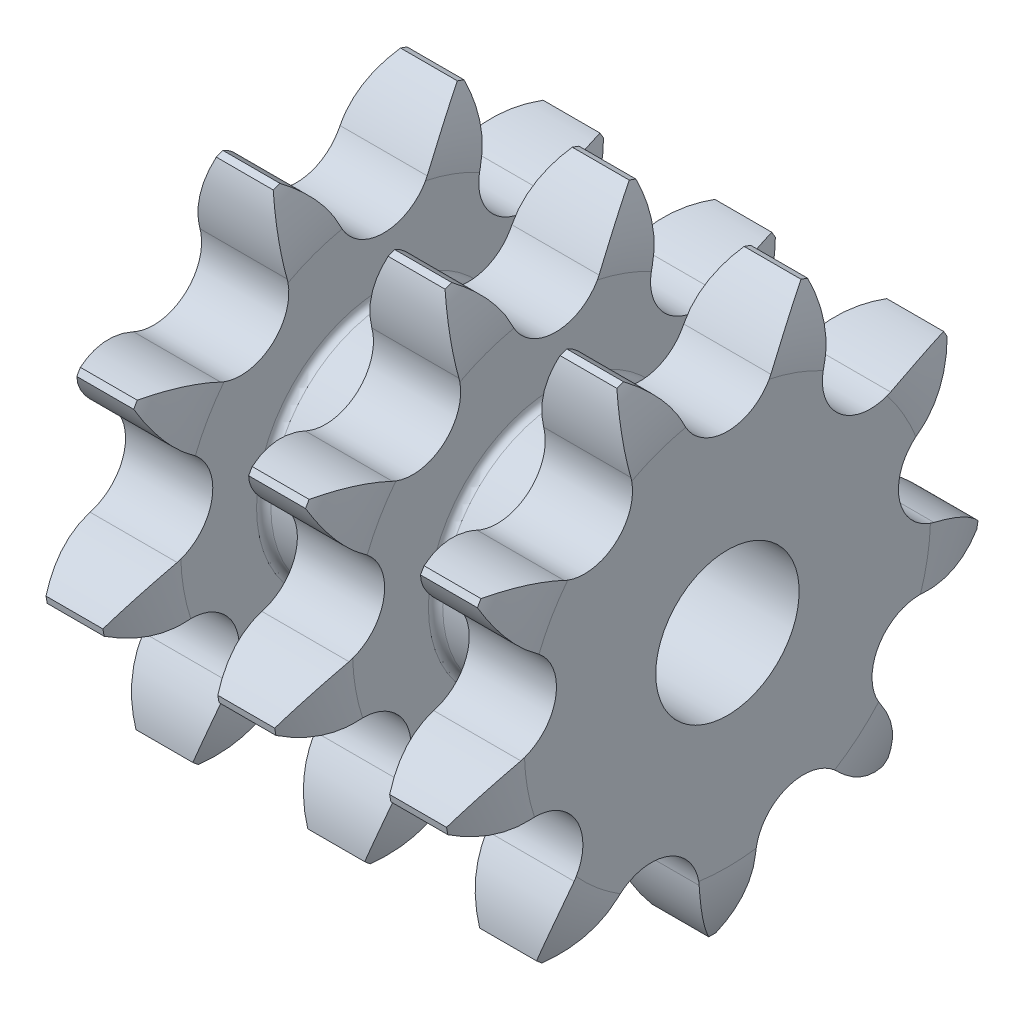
SolidWorks part; units mm, degrees
ref_plane "Plane1" through (0, 0, 0) normal (0, 0, 1) x (1, 0, 0)
ref_plane "Plane2" through (0, 0, 0) normal (0, 1, 0) x (1, 0, 0)
ref_plane "Plane3" through (0, 0, 0) normal (1, 0, 0) x (0, 0, -1)
sketch "Clipboard" plane through (0, 0, 0) normal (0, 1, 0) x (1, 0, 0)
  line L0 (0, 0) -> (12.5436, -1.9867)
  line L1 (-15, 0) -> (100, 0) construction
  line L2 (0, 0) -> (-0.8416, 0.9512)
  line L3 (0, 0) -> (-11.863, 4.5341)
  line L4 (0, 0) -> (3.0618, 0.4849)
  line L5 (0, 0) -> (-2.8109, -1.0484)
  line L6 (0, 0) -> (-29.8924, -20.1685)
  line L7 (-0.8416, 0.9512) -> (36.5829, 8.906)
  line L8 (-76.2, 38.1) -> (-75.2, 38.1)
  line L9 (-73.4321, 41.7084) -> (-72.837, 41.7846)
  line L10 (-73.4741, 12.9512) -> (-59.0941, 12.9512)
  circle A0 centre (0, 0) radius 3.975
  circle A1 centre (0, 0) radius 10.0465
  circle A2 centre (0, 0) radius 25
sketch "BasProSke" plane through (0, 0, 0) normal (0, 1, 0) x (1, 0, 0)
  line L0 (-10, 0) -> (60, 0) construction
  line L1 (0, 0) -> (0, 16.9929)
  line L2 (0, 0) -> (36.06, 0)
  line L3 (36.06, 0) -> (36.06, 16.9929)
  line L4 (34.79, 22.5287) -> (1.27, 22.5287)
  arc A0 (0, 16.9929) -> (1.27, 22.5287) centre (12.7, 16.9929) cw
  arc A1 (36.06, 16.9929) -> (34.79, 22.5287) centre (23.36, 16.9929) ccw
revolve "Base-Revolve" add sketch "BasProSke" angle 360 about L0
sketch "GrvSke" plane through (0, 0, 0) normal (0, 1, 0) x (1, 0, 0)
  line L0 (7.3, 16.9929) -> (7.3, 10.6465)
  line L1 (7.9, 10.0465) -> (13.78, 10.0465)
  line L2 (14.38, 10.6465) -> (14.38, 16.9929)
  line L3 (6.03, 22.5287) -> (15.65, 22.5287)
  line L4 (10.84, 0) -> (10.84, 52.07) construction
  line L5 (-10, 0) -> (60, 0) construction
  line L6 (0, 0) -> (35.56, 0) construction
  arc A0 (14.38, 16.9929) -> (15.65, 22.5287) centre (27.08, 16.9929) cw
  arc A1 (7.3, 16.9929) -> (6.03, 22.5287) centre (-5.4, 16.9929) ccw
  arc A2 (7.3, 10.6465) -> (7.9, 10.0465) centre (7.9, 10.6465) ccw
  arc A3 (13.78, 10.0465) -> (14.38, 10.6465) centre (13.78, 10.6465) ccw
revolve "Groove" cut sketch "GrvSke" angle 360 about L6
pattern_linear "Grooves" count 2 spacing 14.38 along (1, 0, 0) of "Groove"
sketch "TooCutSke" plane through (0, 0, 0) normal (1, 0, 0) x (0, 0, -1)
  line L0 (0, 18.6059) -> (3.6386, 16.9092) construction
  line L1 (0, 0) -> (0, 107) construction
  line L2 (0, 18.6059) -> (-10, 18.6059) construction
  line L3 (0, 18.6059) -> (-3.6386, 16.9092) construction
  arc A0 (3.6386, 16.9092) -> (7.9748, 21.6037) centre (13.1494, 12.4742) cw
  arc A1 (3.6386, 16.9092) -> (-3.6386, 16.9092) centre (0, 18.6059) cw
  arc A2 (-3.6386, 16.9092) -> (-7.9748, 21.6037) centre (-13.1494, 12.4742) ccw
  arc A3 (7.9748, 21.6037) -> (-7.9748, 21.6037) centre (0, 0) ccw
extrude "ToothCut" cut sketch "TooCutSke" along normal through all
pattern_circular "TeethCuts" count 9 every 40 about axis through (-10, 0, 0) along (1, 0, 0) of "ToothCut"
sketch "HubNeaOneSke" plane through (0, 0, 0) normal (-1, 0, 0) x (0, 0, 1)
  circle A0 centre (0, 0) radius 10.0465
extrude "HubNearOne" [suppressed] add sketch "HubNeaOneSke" along normal blind 2.2005
fillet "HubNearOneFillet" [suppressed] radius 0.6
sketch "HubNeaBotSke" plane through (0, 0, 0) normal (-1, 0, 0) x (0, 0, 1)
  circle A0 centre (0, 0) radius 10.0465
extrude "HubNearBoth" [suppressed] add sketch "HubNeaBotSke" along normal blind 1.1003
fillet "HubNearBothFillet" [suppressed] radius 0.6
ref_plane "FarPln" through (36.06, 0, 0) normal (1, 0, 0) x (0, 0, -1)
sketch "HubFarSke" plane through (36.06, 0, 0) normal (1, 0, 0) x (0, 0, -1)
  circle A0 centre (0, 0) radius 10.0465
extrude "HubFar" [suppressed] add sketch "HubFarSke" along normal blind 1.1003
fillet "HubFarFillet" [suppressed] radius 0.6
sketch "BorSke" plane through (0, 0, 0) normal (1, 0, 0) x (0, 0, -1)
  circle A0 centre (0, 0) radius 6
extrude "Bore" cut sketch "BorSke" along normal mid plane 76.521
sketch "KeySke" plane through (0, 0, 0) normal (1, 0, 0) x (0, 0, -1)
  line L0 (-1, 0) -> (-1, 7)
  line L1 (-1, 7) -> (1, 7)
  line L2 (1, 7) -> (1, 0)
  line L3 (0, 0) -> (0, 34) construction
  line L4 (-1, 0) -> (1, 0)
extrude "Keyway" [suppressed] cut sketch "KeySke" along normal mid plane 76.521
pattern_circular "Keyway2" [suppressed] count 2 every 90 about axis through (-10, 0, 0) along (1, 0, 0)
equation "\"Num_teethClipboard_v1\" =  int( \"Num_teeth@Clipboard\" )"
equation "\"Num_teethClipboard_v2\" =  ((sgn( \"Num_teethClipboard_v1\" - 5.0)+1)*( \"Num_teethClipboard_v1\" - 5.0))/2 +5.0"
equation "\"Num_teeth@Clipboard\" =  ((sgn( \"Num_teethClipboard_v2\" - 200.0)-1)*( \"Num_teethClipboard_v2\" - 200.0))/-2 +200.0"
equation "\"MHDClipboard_v1\" =  \"Pitch@Clipboard\" * (1.0 / tan(3.14159265 / \"Num_teeth@Clipboard\" )) - 1.05 * \"Plate_wid@Clipboard\" - 2.0 * \"Fillet_rad@Clipboard\" - 1.0"
equation "\"Thickness@Clipboard\" =  \"Face_width@Clipboard\" + (\"Num_strands@Clipboard\" - 1) * \"Transv_pitch@Clipboard\""
equation "\"OALClipboard_v1\" =  \"Thickness@Clipboard\" + 2 * \"Fillet_rad@Clipboard\" + 1"
equation "\"MHD@Clipboard\" =  ((sgn( \"MHDClipboard_v1\" - \"Hub_dia@Clipboard\" )-1)*( \"MHDClipboard_v1\" - \"Hub_dia@Clipboard\" ))/-2+ \"Hub_dia@Clipboard\""
equation "\"OAL@Clipboard\" =  ((sgn( \"OALClipboard_v1\" - \"Overall_len@Clipboard\" )+1)*( \"OALClipboard_v1\" - \"Overall_len@Clipboard\" ))/2 + \"Overall_len@Clipboard\" + 0.0005"
equation "\"Num_teethTeethCuts_v1\" =  int( \"Show_teeth@Clipboard\" ) + 1"
equation "\"Num_teethTeethCuts_v2\" =  ((sgn( \"Num_teethTeethCuts_v1\" - \"Num_teeth@Clipboard\" )-1)*( \"Num_teethTeethCuts_v1\" - \"Num_teeth@Clipboard\" ))/-2+ \"Num_teeth@Clipboard\""
equation "\"Num_teeth@TeethCuts\" =  ((sgn( \"Num_teethTeethCuts_v2\" - 2.0)+1)*( \"Num_teethTeethCuts_v2\" - 2.0))/2 +2.0"
equation "\"Angle@TeethCuts\" =  360.0 / \"Num_teeth@Clipboard\""
equation "\"Seat_radius@TooCutSke\" =  ( \"Pitch@Clipboard\" / 2.0) / sin(3.14159265 / \"Num_teeth@Clipboard\" ) - \"Dr@Clipboard\" / 2.0 + \"Dr@Clipboard\" * 0.505"
equation "\"R1@TooCutSke\" =  \"Dr@Clipboard\" * 0.505"
equation "\"X@TooCutSke\" =  140.0 - (90.0 / \"Num_teeth@Clipboard\")"
equation "\"R2@TooCutSke\" =  0.12 * \"Dr@Clipboard\" * ( \"Num_teeth@Clipboard\" + 2.0)"
equation "\"Overcut@TooCutSke\" =  0.5 + 0.625 * \"Pitch@Clipboard\" - 0.5 * \"Dr@Clipboard\"  +  \"Pitch@Clipboard\" / 2.0 / sin(3.14159265 / \"Num_teeth@Clipboard\" )"
equation "\"Diameter@BasProSke\" =  2.0 * ( 0.625 * \"Pitch@Clipboard\" - 0.5 * \"Dr@Clipboard\"  +  \"Pitch@Clipboard\" / 2.0 / sin(3.14159265 / \"Num_teeth@Clipboard\" ))"
equation "\"Thickness@BasProSke\" =  \"Thickness@Clipboard\""
equation "\"G1@BasProSke\" =  \"Side_relief@Clipboard\""
equation "\"G2@BasProSke\" =  \"Side_relief@Clipboard\""
equation "\"D1@BasProSke\" =  \"Side_radius@Clipboard\""
equation "\"Diameter@GrvSke\" =  \"Diameter@BasProSke\""
equation "\"G1@GrvSke\" =  \"Side_relief@Clipboard\""
equation "\"D1@GrvSke\" =  \"Side_radius@Clipboard\""
equation "\"Grv_diam@GrvSke\" =  \"Pitch@Clipboard\" * (1.0 / tan(3.14159265 / \"Num_teeth@Clipboard\" ))- 1.05 * \"Plate_wid@Clipboard\" - 2.0 * \"Fillet_rad@Clipboard\" - 1.0"
equation "\"Grv_width@GrvSke\" =  \"Transv_pitch@Clipboard\" - \"Face_width@Clipboard\""
equation "\"Offset@GrvSke\" =  \"Grv_width@GrvSke\" / 2.0 + \"Face_width@Clipboard\""
equation "\"Fillet_rad@GrvSke\" =  \"Fillet_rad@Clipboard\""
equation "\"Offset@Grooves\" =  \"Transv_pitch@Clipboard\""
equation "\"Num_grvsGrooves_v1\" =  \"Num_strands@Clipboard\""
equation "\"Num_grvs@Grooves\" =  \"Num_grvsGrooves_v1\" - 1 * sgn( \"Num_grvsGrooves_v1\" -1)"
equation "\"Diameter@HubNeaOneSke\" =  \"MHD@Clipboard\""
equation "\"Length@HubNearOne\" =  \"OAL@Clipboard\" - \"Thickness@BasProSke\""
equation "\"Diameter@HubNeaBotSke\" =  \"MHD@Clipboard\""
equation "\"Length@HubNearBoth\" =  ( \"OAL@Clipboard\" - \"Thickness@BasProSke\" ) / 2.0"
equation "\"D1@HubNearOneFillet\" =  \"Fillet_rad@Clipboard\""
equation "\"D1@HubNearBothFillet\" =  \"Fillet_rad@Clipboard\""
equation "\"Thickness@FarPln\" =  \"Thickness@BasProSke\""
equation "\"Diameter@HubFarSke\" =  \"MHD@Clipboard\""
equation "\"Length@HubFar\" =  ( \"OAL@Clipboard\" - \"Thickness@BasProSke\" ) / 2.0"
equation "\"D1@HubFarFillet\" =  \"Fillet_rad@Clipboard\""
equation "\"D1@Bore\" =  \"OAL@Clipboard\" * 2.0"
equation "\"D1@Keyway\" =  \"OAL@Clipboard\" * 2.0"
equation "\"Offset@KeySke\" =  \"T_dim@Clipboard\" + \"Diameter@BorSke\" / 2.0"
